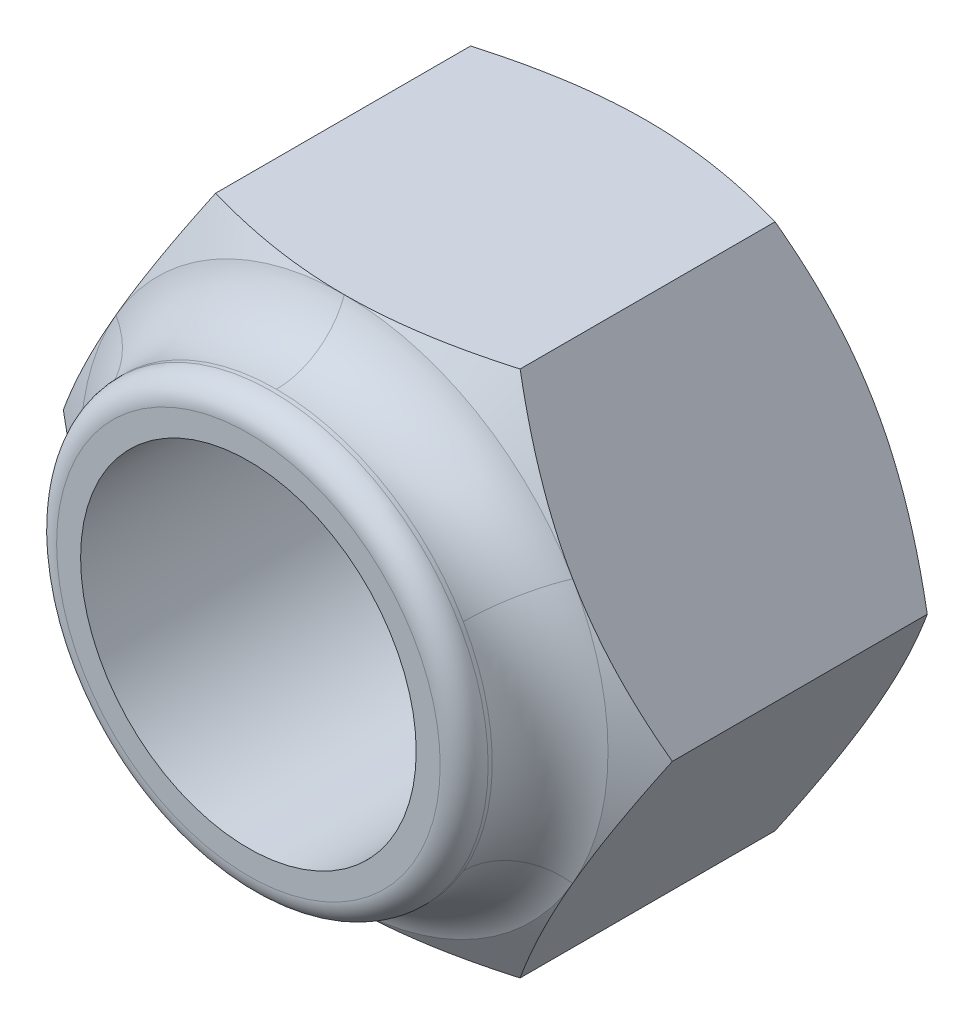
SolidWorks part; units mm, degrees
ref_plane "Plan1" through (0, 0, 0) normal (0, 0, 1) x (1, 0, 0)
ref_plane "Plan2" through (0, 0, 0) normal (0, 1, 0) x (1, 0, 0)
ref_plane "Plan3" through (0, 0, 0) normal (1, 0, 0) x (0, 0, -1)
sketch "Esquisse1" plane through (0, 0, 0) normal (0, 0, 1) x (1, 0, 0)
  line L0 (-6.3509, -11) -> (-12.7017, 0)
  line L1 (6.3509, -11) -> (-6.3509, -11)
  line L2 (12.7017, 0) -> (6.3509, -11)
  line L3 (-12.7017, 0) -> (-6.3509, 11)
  line L4 (-6.3509, 11) -> (6.3509, 11)
  line L5 (6.3509, 11) -> (12.7017, 0)
  circle A0 centre (0, 0) radius 7
  dimension "D6" = 14
  dimension "D1" = 11
  dimension "D2" = 11
  dimension "D3" = 11
  dimension "D4" = 11
  dimension "D5" = 11
extrude "Base-Extrusion" add sketch "Esquisse1" along normal blind 12.6
sketch "Esquisse2" plane through (0, 0, 0) normal (0, 0, -1) x (-1, 0, 0)
  line L0 (12.7017, 0) -> (6.3509, 11) construction
  circle A0 centre (0, 0) radius 14.8072
  circle A1 centre (0, 0) radius 11
extrude "Enlèv. mat.-Extru.1" cut sketch "Esquisse2" against normal blind 5 draft 60
sketch "Esquisse3" plane through (0, 0, 12.6) normal (0, 0, 1) x (1, 0, 0)
  line L0 (-12.7017, 0) -> (-6.3509, 11) construction
  circle A0 centre (0, 0) radius 11
  circle A1 centre (0, 0) radius 15.1052
extrude "Enlèv. mat.-Extru.2" cut sketch "Esquisse3" against normal blind 5 draft 60
sketch "Esquisse4" plane through (0, 0, 12.6) normal (0, 0, 1) x (1, 0, 0)
  circle A0 centre (0, 0) radius 9
  circle A1 centre (0, 0) radius 7
  dimension "D1" = 18
  dimension "D2" = 14
extrude "Boss.-Extru.1" add sketch "Esquisse4" along normal blind 4
fillet "Congé2" radius 1
fillet "Congé3" radius 3
